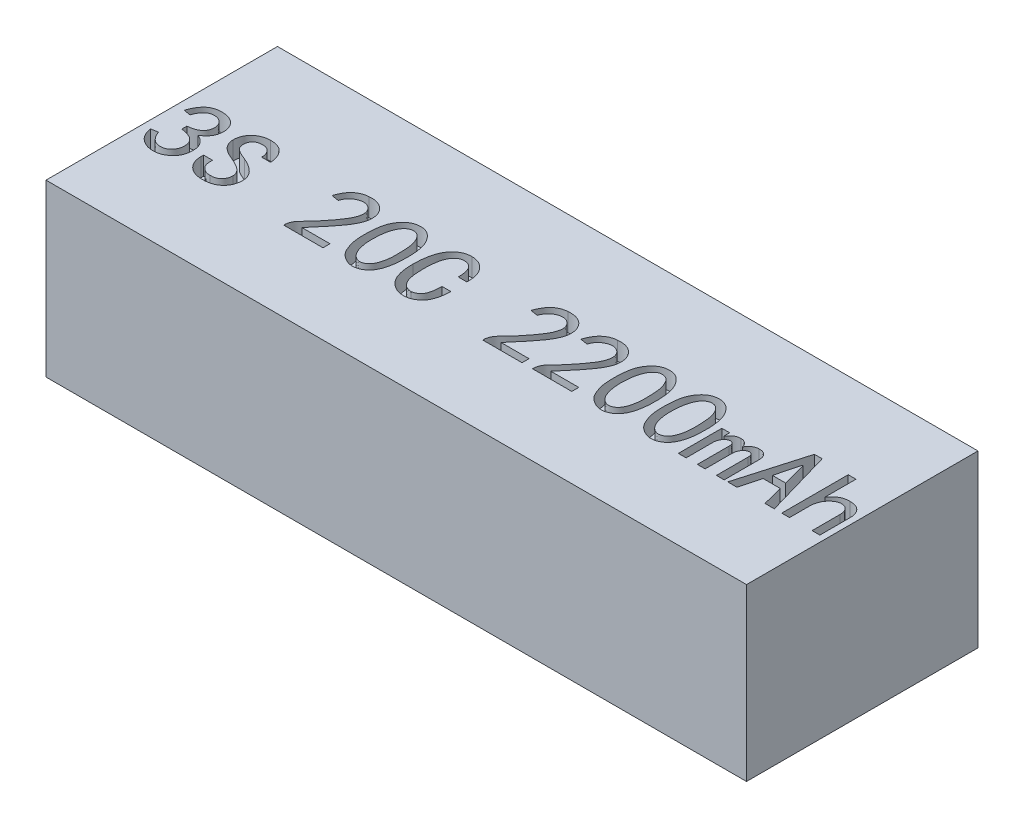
SolidWorks part; units mm, degrees
ref_plane "前视基准面" through (0, 0, 0) normal (0, 0, 1) x (1, 0, 0)
ref_plane "上视基准面" through (0, 0, 0) normal (0, 1, 0) x (1, 0, 0)
ref_plane "右视基准面" through (0, 0, 0) normal (1, 0, 0) x (0, 0, -1)
other "Configuration Table"
sketch "草图1" plane through (0, 0, 0) normal (0, 1, 0) x (1, 0, 0)
  line L1 (57.5, 30.8796) -> (-57.5, 30.8796)
  line L2 (57.5, 30.8796) -> (57.5, -7.1204)
  line L3 (57.5, -7.1204) -> (-57.5, -7.1204)
  line L4 (-57.5, 30.8796) -> (-57.5, -7.1204)
  line L5 (0, -7.1204) -> (0, 30.8796) construction
  line L6 (57.5, 11.8796) -> (-57.5, 11.8796) construction
  point P0 (0, 11.8796)
  dimension "D1" = 115
  dimension "D2" = 38
extrude "凸台-拉伸1" add sketch "草图1" along normal blind 28
sketch "草图2" plane through (0, 28, 0) normal (0, 1, 0) x (1, 0, 0)
  text T0 "3S 20C 2200mAh" font "楷体" height in points 36
extrude "切除-拉伸1" cut sketch "草图2" against normal blind 3
